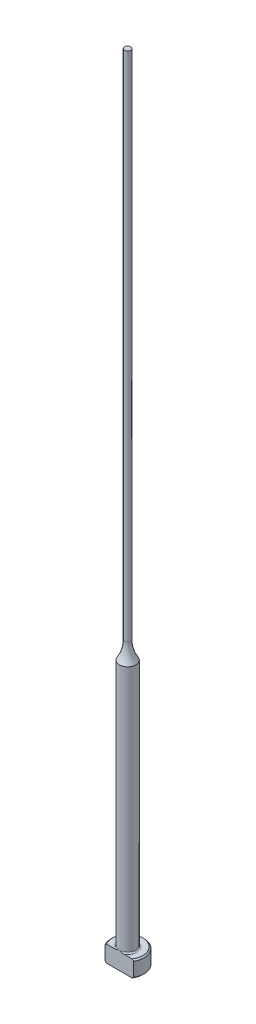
SolidWorks part; units mm, degrees
ref_plane "Front Plane" through (0, 0, 0) normal (0, 0, 1) x (1, 0, 0)
ref_plane "Top Plane" through (0, 0, 0) normal (0, 1, 0) x (1, 0, 0)
ref_plane "Right Plane" through (0, 0, 0) normal (1, 0, 0) x (0, 0, -1)
sketch "Sketch1" plane through (0, 0, 0) normal (0, 0, 1) x (1, 0, 0)
  line L0 (0, 259.9588) -> (0, -15.1925) construction
  line L1 (0, 0) -> (-3.175, 0)
  line L2 (-3.175, 0) -> (-3.175, 3.175)
  line L3 (-3.175, 3.175) -> (-1.5875, 3.175)
  line L4 (-0.5944, 54.2098) -> (-0.5944, 152.4)
  line L5 (-0.5944, 152.4) -> (0, 152.4)
  line L6 (0, 152.4) -> (0, 0)
  line L7 (-1.5875, 3.175) -> (-1.5875, 50.8)
  arc A0 (-1.5875, 50.8) -> (-0.5944, 54.2098) centre (-6.9444, 54.2098) ccw
  point P13 (-1.5875, 0)
  dimension "D1" = 6.35
  dimension "L" = 152.4
  dimension "D2" = 3.175
  dimension "H" = 6.35
  dimension "T" = 3.175
  dimension "D" = 1.1887
  dimension "S" = 50.8
revolve "Revolve1" add sketch "Sketch1" angle 360 about L0
chamfer "Chamfer1" distance 0.254 angle 45 2 edges at (0, 3.175, 3.175) (0, 0, 3.175)
fillet "Fillet1" radius 0.254 1 edges at (0, 3.175, 1.5875)
sketch "Sketch2" plane through (0, 0, 0) normal (0, -1, 0) x (1, 0, 0)
  line L0 (-2.7496, 1.5875) -> (2.7496, 1.5875)
  arc A0 (2.7496, 1.5875) -> (-2.7496, 1.5875) centre (0, 0) ccw
  circle A1 centre (0, 0) radius 3.175 construction
  circle A2 centre (0, 0) radius 1.5875 construction
extrude "Cut-Extrude1" cut sketch "Sketch2" against normal through all
